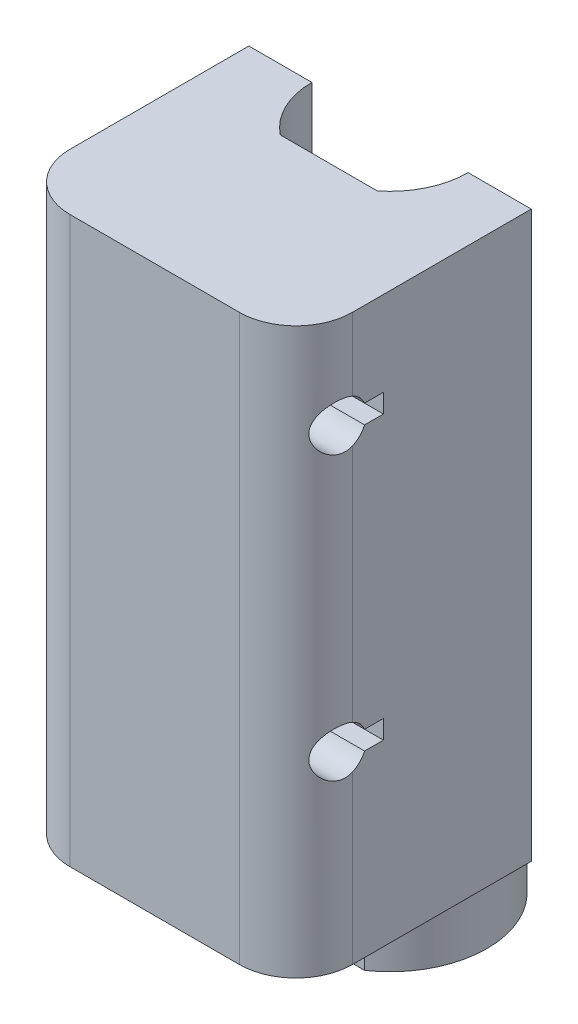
SolidWorks part; units mm, degrees
ref_plane "Front Plane" through (0, 0, 0) normal (0, 0, 1) x (1, 0, 0)
ref_plane "Top Plane" through (0, 0, 0) normal (0, 1, 0) x (1, 0, 0)
ref_plane "Right Plane" through (0, 0, 0) normal (1, 0, 0) x (0, 0, -1)
sketch "Sketch1" plane through (0, 0, 0) normal (0, 1, 0) x (1, 0, 0)
  line L0 (-6.5389, 8.2677) -> (6.5389, 8.2677)
  line L1 (-6.5389, -8.2677) -> (6.5389, -8.2677)
  arc A0 (-6.5389, 8.2677) -> (-6.5389, -8.2677) centre (0, 0) ccw
  arc A1 (6.5389, -8.2677) -> (6.5389, 8.2677) centre (0, 0) ccw
  dimension "D1" = 21.082
  dimension "D2" = 16.5354
  dimension "D3" = 8.2677
extrude "Boss-Extrude1" add sketch "Sketch1" along normal blind 2.54
sketch "Sketch2" plane through (0, 0, 0) normal (0, 1, 0) x (1, 0, 0)
  line L8 (-7.3693, -10.8077) -> (7.3693, -10.8077)
  line L9 (7.3693, 10.8077) -> (-7.3693, 10.8077)
  line L10 (-7.3693, -10.8077) -> (7.3693, -10.8077)
  line L11 (7.3693, 10.8077) -> (-7.3693, 10.8077)
  line L12 (-6.5389, -8.2677) -> (6.5389, -8.2677)
  line L13 (6.5389, 8.2677) -> (-6.5389, 8.2677)
  line L14 (-6.5389, -8.2677) -> (6.5389, -8.2677)
  line L15 (6.5389, 8.2677) -> (-6.5389, 8.2677)
  arc A6 (7.3693, -10.8077) -> (7.3693, 10.8077) centre (0, 0) ccw
  arc A7 (-7.3693, 10.8077) -> (-7.3693, -10.8077) centre (0, 0) ccw
  arc A8 (7.3693, -10.8077) -> (7.3693, 10.8077) centre (0, 0) ccw
  arc A9 (-7.3693, 10.8077) -> (-7.3693, -10.8077) centre (0, 0) ccw
  arc A10 (-6.5389, 8.2677) -> (-6.5389, -8.2677) centre (0, 0) ccw
  arc A11 (6.5389, -8.2677) -> (6.5389, 8.2677) centre (0, 0) ccw
  arc A12 (-6.5389, 8.2677) -> (-6.5389, -8.2677) centre (0, 0) ccw
  arc A13 (6.5389, -8.2677) -> (6.5389, 8.2677) centre (0, 0) ccw
  dimension "D1" = 2.54
  dimension "D2" = 0
extrude "Boss-Extrude2" add sketch "Sketch2" along normal blind 29.0576
sketch "Sketch3" plane through (0, 2.54, 0) normal (0, 1, 0) x (1, 0, 0)
  circle A0 centre (0, 0) radius 1.5875
  dimension "D1" = 3.175
extrude "Cut-Extrude1" cut sketch "Sketch3" against normal through all
sketch "Sketch4" plane through (0, 0, 10.8077) normal (0, 0, 1) x (1, 0, 0)
  line L0 (-13.081, 29.0576) -> (-13.081, 0) construction
  line L1 (-13.081, 2.54) -> (13.081, 2.54)
  line L2 (-13.081, 2.54) -> (-13.081, 15.875)
  line L3 (-13.081, 15.875) -> (13.081, 15.875)
  line L4 (13.081, 2.54) -> (13.081, 15.875)
  line L5 (13.081, 0) -> (13.081, 29.0576) construction
  line L6 (-7.3693, 0) -> (7.3693, 0) construction
  dimension "D1" = 13.335
  dimension "D2" = 2.54
extrude "Cut-Extrude2" cut sketch "Sketch4" against normal blind 5.08
sketch "Sketch5" plane through (0, 0, 10.8077) normal (0, 0, 1) x (1, 0, 0)
  line L0 (13.081, 0) -> (13.081, 29.0576) construction
  line L1 (13.081, 15.875) -> (-13.081, 15.875)
  line L2 (13.081, 15.875) -> (13.081, 0)
  line L3 (13.081, 0) -> (-13.081, 0)
  line L4 (-13.081, 15.875) -> (-13.081, 0)
  line L5 (-13.081, 29.0576) -> (-13.081, 0) construction
  line L6 (7.3693, 15.875) -> (-7.3693, 15.875) construction
extrude "Cut-Extrude3" cut sketch "Sketch5" against normal through all
sketch "Sketch6" plane through (0, 29.0576, 0) normal (0, 1, 0) x (1, 0, 0)
  line L0 (-6.5389, -8.2677) -> (6.5389, -8.2677) construction
  line L2 (-6.5389, -8.2677) -> (6.5389, -8.2677)
  line L3 (-10.541, 0) -> (-19.05, 0)
  line L4 (-19.05, 0) -> (-19.05, -24.13)
  line L5 (-11.43, -31.75) -> (11.43, -31.75)
  line L6 (19.05, -24.13) -> (19.05, 0)
  line L7 (19.05, 0) -> (10.541, 0)
  arc A0 (-6.5389, 8.2677) -> (-6.5389, -8.2677) centre (0, 0) ccw construction
  arc A1 (6.5389, -8.2677) -> (6.5389, 8.2677) centre (0, 0) ccw construction
  arc A2 (11.43, -31.75) -> (19.05, -24.13) centre (11.43, -24.13) ccw
  arc A3 (-19.05, -24.13) -> (-11.43, -31.75) centre (-11.43, -24.13) ccw
  arc A4 (-10.541, 0) -> (-6.5389, -8.2677) centre (0, 0) ccw
  arc A5 (6.5389, -8.2677) -> (10.541, 0) centre (0, 0) ccw
  point P13 (19.05, -31.75)
  point P16 (-19.05, -31.75)
  dimension "D4" = 7.62
  dimension "D1" = 38.1
  dimension "D2" = 31.75
  dimension "D3" = 19.05
extrude "Boss-Extrude3" add sketch "Sketch6" along normal blind 76.2
sketch "Sketch7" plane through (19.05, 0, 0) normal (1, 0, 0) x (0, 0, -1)
  line L0 (-22.4901, 55.7276) -> (-19.9501, 55.7276)
  line L1 (-19.9501, 55.7276) -> (-19.9501, 53.1876)
  line L2 (-19.9501, 53.1876) -> (-22.4901, 53.1876)
  line L3 (-24.13, 105.2576) -> (0, 105.2576) construction
  line L4 (0, 105.2576) -> (0, 29.0576) construction
  line L5 (-22.4901, 93.8276) -> (-19.9501, 93.8276)
  line L6 (-19.9501, 93.8276) -> (-19.9501, 91.2876)
  line L7 (-19.9501, 91.2876) -> (-22.4901, 91.2876)
  arc A0 (-22.4901, 93.8276) -> (-22.4901, 91.2876) centre (-25.4, 92.5576) ccw
  arc A1 (-22.4901, 55.7276) -> (-22.4901, 53.1876) centre (-25.4, 54.4576) ccw
  dimension "D1" = 6.35
  dimension "D2" = 6.35
  dimension "D3" = 25.4
  dimension "D4" = 25.4
  dimension "D5" = 12.7
  dimension "D6" = 38.1
  dimension "D7" = 2.54
  dimension "D8" = 1.27
  dimension "D9" = 2.54
  dimension "D10" = 2.54
  dimension "D11" = 1.27
  dimension "D12" = 2.54
extrude "Cut-Extrude4" cut sketch "Sketch7" against normal through all
chamfer "Chamfer1" distance 5.588 angle 45 3 edges at (11.5653, 29.0576, 6.1121) (-11.5653, 29.0576, 6.1121) (0, 29.0576, 10.8077)
sketch "Sketch8" plane through (0, 0, 0) normal (0, 0, -1) x (-1, 0, 0)
  line L0 (7.3693, 29.0576) -> (7.3693, 15.875) construction
  line L1 (-7.3693, 29.0576) -> (-13.4653, 29.0576)
  line L2 (-7.3693, 29.0576) -> (-7.3693, 38.2016)
  line L3 (-7.3693, 38.2016) -> (-13.4653, 38.2016)
  line L4 (-13.4653, 29.0576) -> (-13.4653, 38.2016)
  line L5 (7.3693, 29.0576) -> (13.4653, 29.0576)
  line L6 (7.3693, 29.0576) -> (7.3693, 38.2016)
  line L7 (7.3693, 38.2016) -> (13.4653, 38.2016)
  line L8 (13.4653, 29.0576) -> (13.4653, 38.2016)
  line L9 (-7.3693, 29.0576) -> (7.3693, 29.0576) construction
  line L10 (-7.3693, 29.0576) -> (-7.3693, 15.875) construction
  dimension "D1" = 9.144
  dimension "D2" = 6.096
  dimension "D3" = 9.144
  dimension "D4" = 6.096
extrude "Cut-Extrude5" cut sketch "Sketch8" against normal blind 2.54
